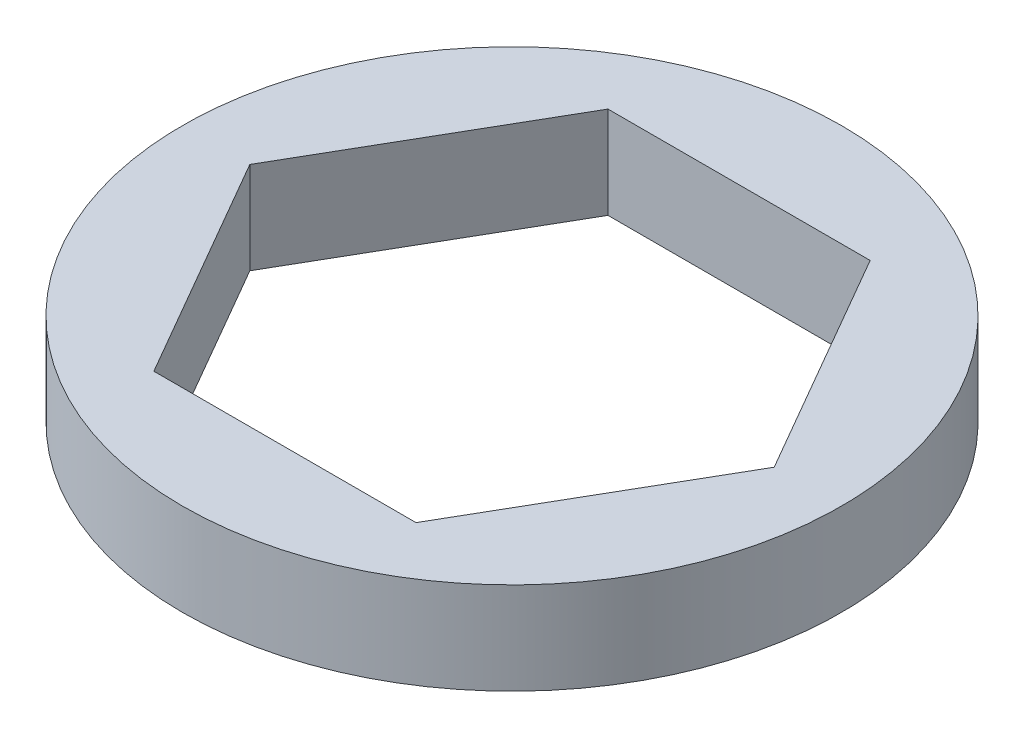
SolidWorks part; units mm, degrees
ref_plane "Front Plane" through (0, 0, 0) normal (0, 0, 1) x (1, 0, 0)
ref_plane "Top Plane" through (0, 0, 0) normal (0, 1, 0) x (1, 0, 0)
ref_plane "Right Plane" through (0, 0, 0) normal (1, 0, 0) x (0, 0, -1)
sketch "Sketch1" plane through (0, 0, 0) normal (0, 1, 0) x (1, 0, 0)
  line L1 (2.0207, 3.5) -> (-2.0207, 3.5)
  line L2 (-2.0207, 3.5) -> (-4.0415, 0)
  line L3 (-4.0415, 0) -> (-2.0207, -3.5)
  line L4 (-2.0207, -3.5) -> (2.0207, -3.5)
  line L5 (2.0207, -3.5) -> (4.0415, 0)
  line L6 (4.0415, 0) -> (2.0207, 3.5)
  circle A0 centre (0, 0) radius 3.5 construction
  circle A1 centre (0, 0) radius 5.08
  dimension "D1" = 7
  dimension "D2" = 10.16
extrude "Boss-Extrude1" add sketch "Sketch1" along normal blind 1.4195
